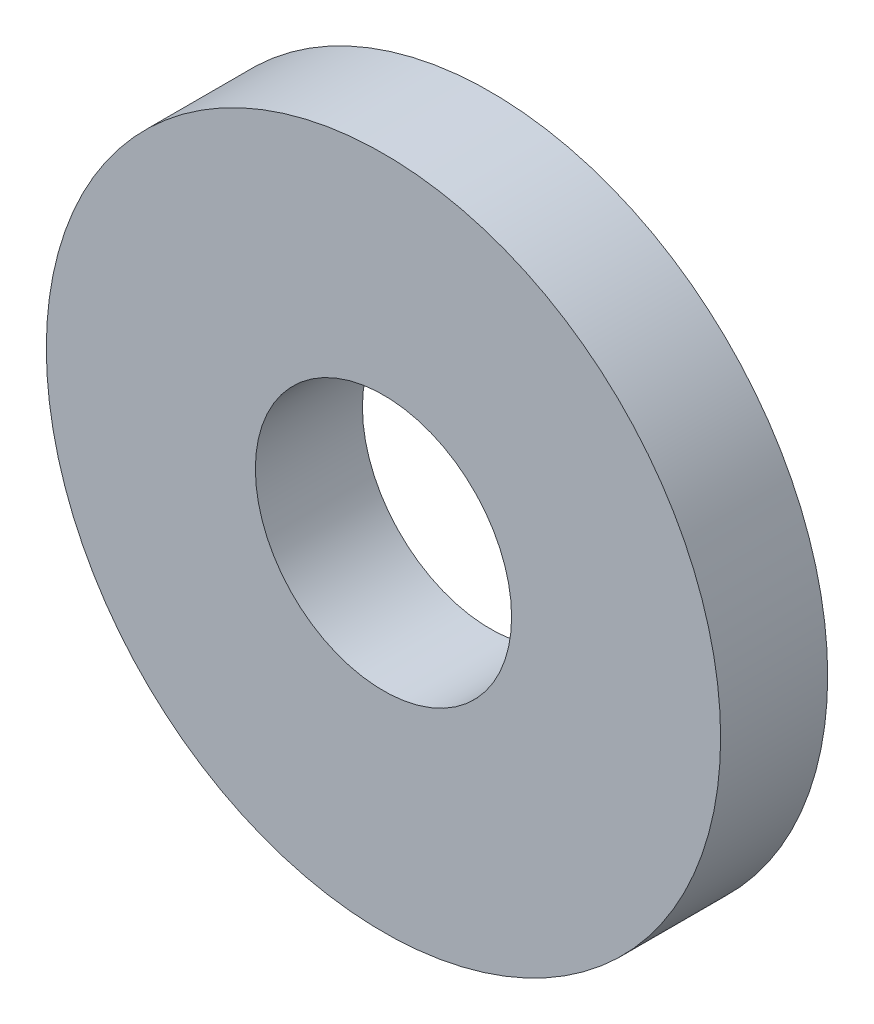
SolidWorks part; units mm, degrees
ref_plane "Front Plane" through (0, 0, 0) normal (0, 0, 1) x (1, 0, 0)
ref_plane "Top Plane" through (0, 0, 0) normal (0, 1, 0) x (1, 0, 0)
ref_plane "Right Plane" through (0, 0, 0) normal (1, 0, 0) x (0, 0, -1)
sketch "Sketch1" plane through (0, 0, 0) normal (0, 0, 1) x (1, 0, 0)
  circle A1 centre (0, 190) radius 3.8
  circle A2 centre (0, 190) radius 10
  dimension "D1" = 20
extrude "Boss-Extrude1" add sketch "Sketch1" along normal blind 3.175
